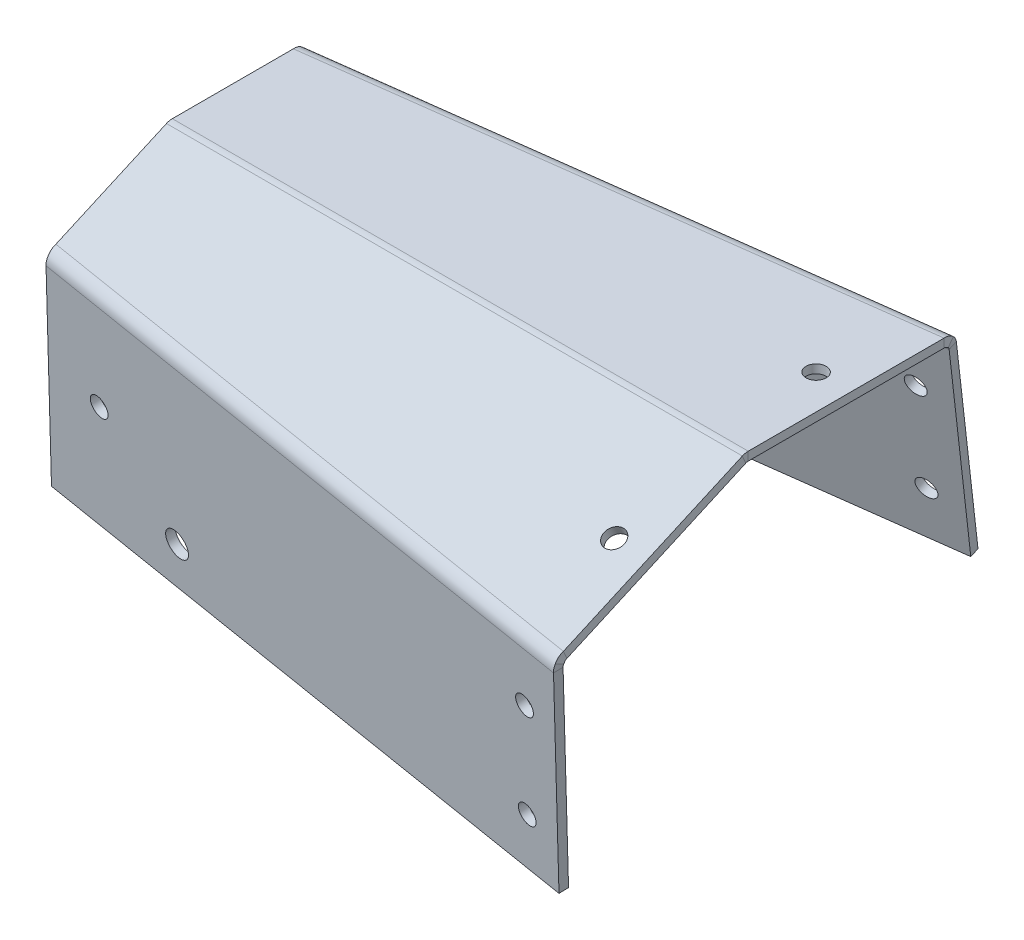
SolidWorks part; units mm, degrees
ref_plane "Front Plane" through (0, 0, 0) normal (0, 0, 1) x (1, 0, 0)
ref_plane "Top Plane" through (0, 0, 0) normal (0, 1, 0) x (1, 0, 0)
ref_plane "Right Plane" through (0, 0, 0) normal (1, 0, 0) x (0, 0, -1)
sketch "Sketch1" plane through (0, 0, 0) normal (0, 1, 0) x (1, 0, 0)
  line L0 (0, 0) -> (100, 0) construction
  line L1 (100, -35) -> (100, 35)
  line L2 (100, 35) -> (90, 75)
  line L3 (90, 75) -> (-10, 62)
  line L4 (-10, 62) -> (0, 22)
  line L5 (0, 22) -> (0, -22)
  line L6 (100, -35) -> (90, -75)
  line L7 (90, -75) -> (-10, -62)
  line L8 (-10, -62) -> (0, -22)
  circle A0 centre (16.9116, 57.4312) radius 2.25
  circle A1 centre (5.355, 41.811) radius 1.75
  circle A2 centre (86.4517, 64.4546) radius 1.75
  circle A3 centre (91.3351, 44.9211) radius 1.75
  circle A4 centre (94, 18) radius 1.75
  circle A5 centre (5.355, -41.811) radius 1.75
  circle A6 centre (16.9116, -57.4312) radius 2.25
  circle A7 centre (86.4517, -64.4546) radius 1.75
  circle A8 centre (91.3351, -44.9211) radius 1.75
  circle A9 centre (94, -18) radius 1.75
  dimension "D7" = 6
  dimension "D8" = 18
  dimension "D9" = 3.5
  dimension "D10" = 3.5
  dimension "D11" = 3.5
  dimension "D12" = 3.5
  dimension "D13" = 8
  dimension "D14" = 25
  dimension "D15" = 4.5
  dimension "D16" = 6
  dimension "D17" = 6
  dimension "D20" = 22
  dimension "D21" = 10
  dimension "D1" = 35
  dimension "D2" = 40
  dimension "D3" = 110
  dimension "D4" = 10
  dimension "D5" = 40
  dimension "D6" = 22
  dimension "D18" = 10
  dimension "D19" = 30
  dimension "D22" = 10
sheet metal parameters "Sheet-Metal1" thickness 1.5 parameters "D1"=1
base flange "Base-Flange1" sketch "Sketch1" thickness 1.5 reverse thickness direction yes parameters "D1"=1
sketch "Sketch3" plane through (0, 1.5, 0) normal (0, 1, 0) x (1, 0, 0)
  line L0 (100, 35) -> (0, 22)
  line L1 (0, -22) -> (100, -35)
sketched bend "Sketched Bend1" parameters "D1"=0
bend "SketchBend1" bend radius 1 bend angle 75 parameters "D5"=1
bend "SketchBend2" bend radius 0 bend angle 75 parameters "D5"=2
sketch "Sketch4" plane through (0, 1.5, 0) normal (0, 1, 0) x (1, 0, 0)
  line L0 (100, 0) -> (0, 0)
  line L1 (100, -34.2262) -> (100, 34.2262) construction
sketched bend "Sketched Bend2" parameters "D1"=1
bend "SketchBend3" bend radius 1 bend angle 24 parameters "D5"=3
flat pattern "Flat-Pattern1"
sketch "Bend-Lines1" plane through (0, 0, 0) normal (0, 1, 0) x (-1, 0, 0)
bend of the flat pattern "Flatten-<SketchBend1>1"
bend of the flat pattern "Flatten-<SketchBend2>1"
bend of the flat pattern "Flatten-<SketchBend3>1"
